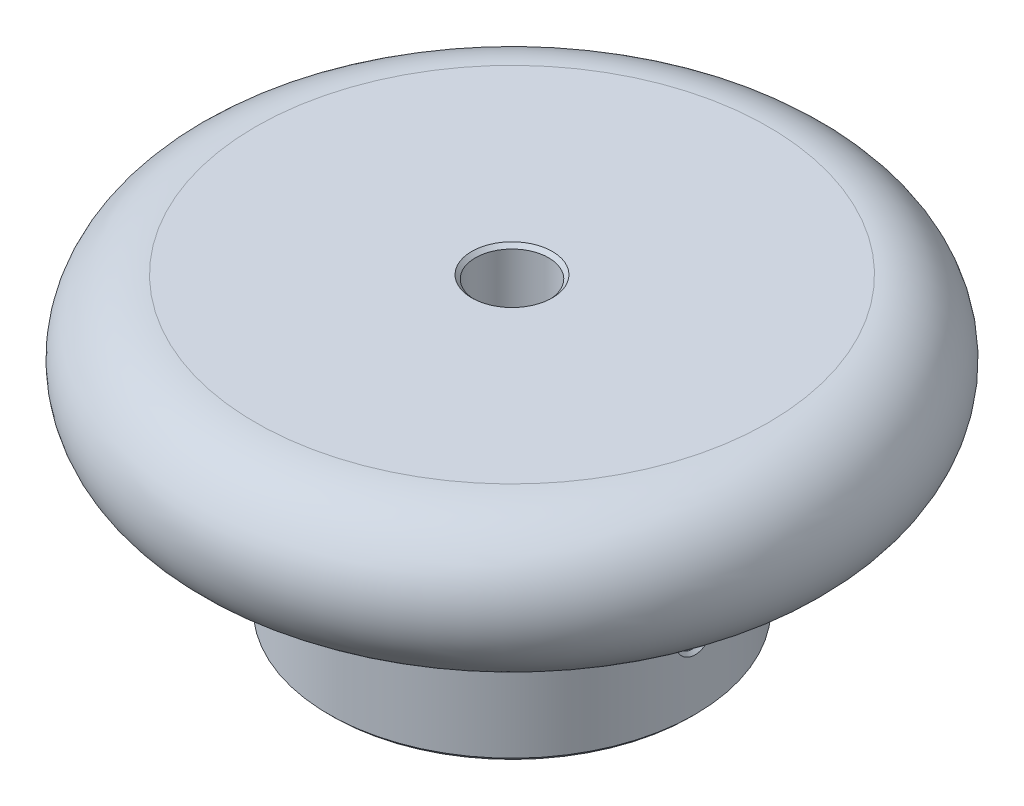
SolidWorks part; units mm, degrees
ref_plane "Спереди" through (0, 0, 0) normal (0, 0, 1) x (1, 0, 0)
ref_plane "Сверху" through (0, 0, 0) normal (0, 1, 0) x (1, 0, 0)
ref_plane "Справа" through (0, 0, 0) normal (1, 0, 0) x (0, 0, -1)
sketch "Эскиз1" plane through (0, 0, 0) normal (0, 0, 1) x (1, 0, 0)
  line L0 (0, 0) -> (0, -40) construction
  line L1 (-5, 0) -> (-5, -10)
  line L2 (-5, -10) -> (-15, -10)
  line L3 (-15, -10) -> (-15, -40)
  line L4 (-15, -40) -> (-25, -40)
  line L5 (-25, -40) -> (-25, -20)
  line L6 (-5, 0) -> (-35, 0)
  line L7 (-35, -20) -> (-25, -20)
  arc A0 (-35, 0) -> (-35, -20) centre (-35, -10) ccw
  dimension "D1" = 10
  dimension "D2" = 30
  dimension "D3" = 50
  dimension "D4" = 30
  dimension "D5" = 10
  dimension "D6" = 70
revolve "Повернуть1" add sketch "Эскиз1" angle 360 about L0
sketch "Эскиз2" plane through (0, 0, 0) normal (1, 0, 0) x (0, 0, -1)
  line L1 (-25, -20) -> (25, -20) construction
  circle A0 centre (0, -30) radius 2
  dimension "D2" = 4
  dimension "D1" = 10
extrude "Вырез-Вытянуть1" cut sketch "Эскиз2" against normal mid plane 50
chamfer "Фаска1" distance 0.5 angle 45 10 edges at (-15, -40, 0) (-15, -10, 0) (-14.9935, -28.049, 0.4401) (14.8726, -29.5599, 1.951) (-25, -40, 0) (-24.9959, -28.0519, -0.4528) (24.924, -30.4528, 1.9481) (-5, -10, 0) (-5, 0, 0) (-25, -20, 0)
